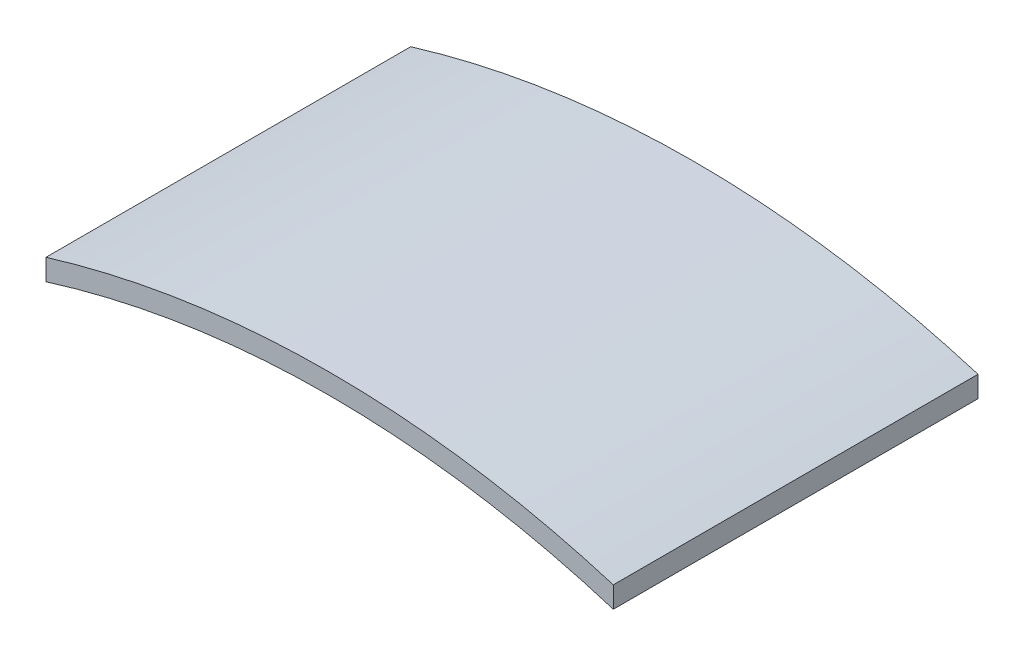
SolidWorks part; units mm, degrees
ref_plane "Front Plane" through (0, 0, 0) normal (0, 0, 1) x (1, 0, 0)
ref_plane "Top Plane" through (0, 0, 0) normal (0, 1, 0) x (1, 0, 0)
ref_plane "Right Plane" through (0, 0, 0) normal (1, 0, 0) x (0, 0, -1)
sketch "Sketch1" plane through (0, 0, 0) normal (0, 0, 1) x (1, 0, 0)
  line L0 (22.225, 71.2255) -> (22.225, 72.8868)
  line L3 (-22.225, 71.2255) -> (-22.225, 72.8868)
  arc A4 (22.225, 72.8868) -> (-22.225, 72.8868) centre (0, 0) ccw
  arc A5 (22.225, 71.2255) -> (-22.225, 71.2255) centre (0, 0) ccw
extrude "Extrude4" add sketch "Sketch1" along normal blind 28.575
